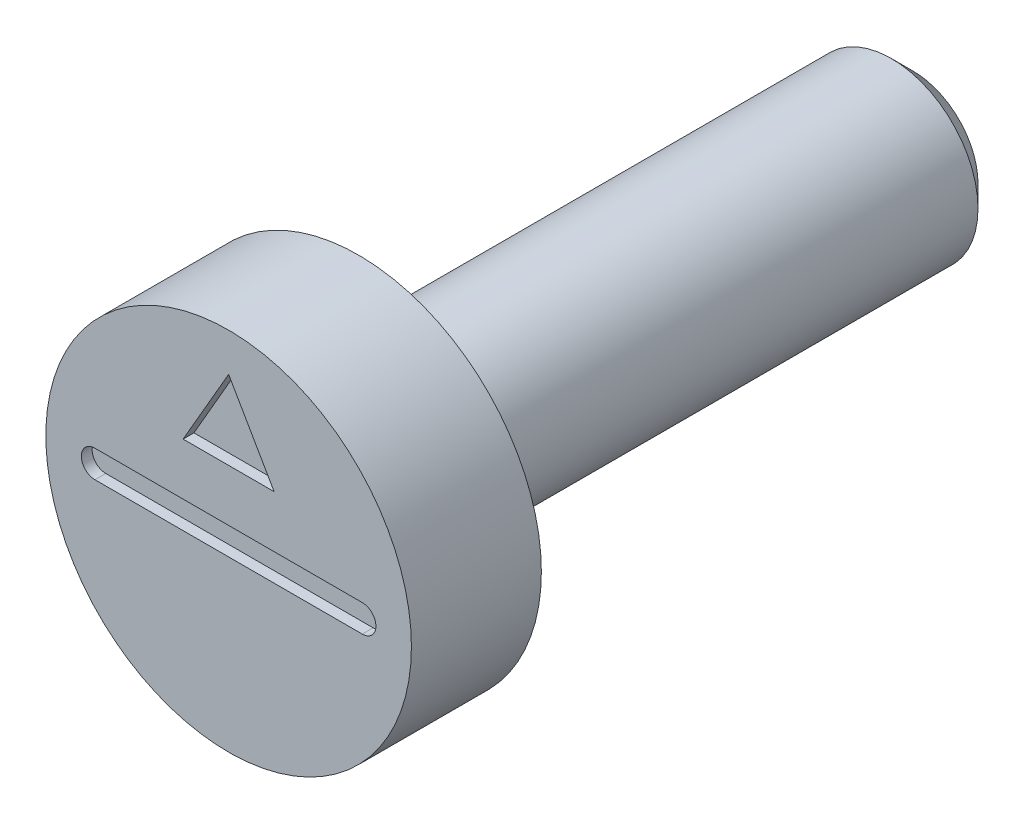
SolidWorks part; units mm, degrees
ref_plane "Front Plane" through (0, 0, 0) normal (0, 0, 1) x (1, 0, 0)
ref_plane "Top Plane" through (0, 0, 0) normal (0, 1, 0) x (1, 0, 0)
ref_plane "Right Plane" through (0, 0, 0) normal (1, 0, 0) x (0, 0, -1)
sketch "Sketch4" plane through (0, 0, 0) normal (1, 0, 0) x (0, 0, -1)
  line L0 (0, 0) -> (0, 4.22)
  line L1 (0, 4.22) -> (3, 4.22)
  line L2 (3, 4.22) -> (3, 2)
  line L3 (3, 2) -> (15.8, 2)
  line L4 (15.8, 2) -> (15.8, 0)
  line L5 (15.8, 0) -> (0, 0)
  line L6 (-3.7474, 0) -> (21.1158, 0) construction
  dimension "D1" = 4
  dimension "D2" = 8.44
  dimension "D3" = 15.8
  dimension "D4" = 3
revolve "Revolve1" add sketch "Sketch4" angle 360 about L6
sketch "Sketch1" plane through (0, 0, 0) normal (0, 0, 1) x (1, 0, 0)
  line L0 (0, 3.335) -> (-1.0508, 1.515)
  line L1 (-1.0508, 1.515) -> (1.0508, 1.515)
  line L2 (1.0508, 1.515) -> (0, 3.335)
  line L3 (0, 0.315) -> (0, 0) construction
  line L4 (-3.085, 0.315) -> (3.085, 0.315)
  line L6 (-3.085, -0.315) -> (3.085, -0.315)
  arc A0 (-3.085, 0.315) -> (-3.085, -0.315) centre (-3.085, 0) ccw
  arc A1 (3.085, -0.315) -> (3.085, 0.315) centre (3.085, 0) ccw
  dimension "D5" = 6.8
  dimension "D1" = 1.82
  dimension "D2" = 60
  dimension "D3" = 60
  dimension "D4" = 0.63
  dimension "D7" = 0.315
  dimension "D8" = 1.2
extrude "Cut-Extrude1" cut sketch "Sketch1" against normal blind 0.25
chamfer "Chamfer1" distance 0.5 angle 45 1 edges at (2, 0, -15.8)
